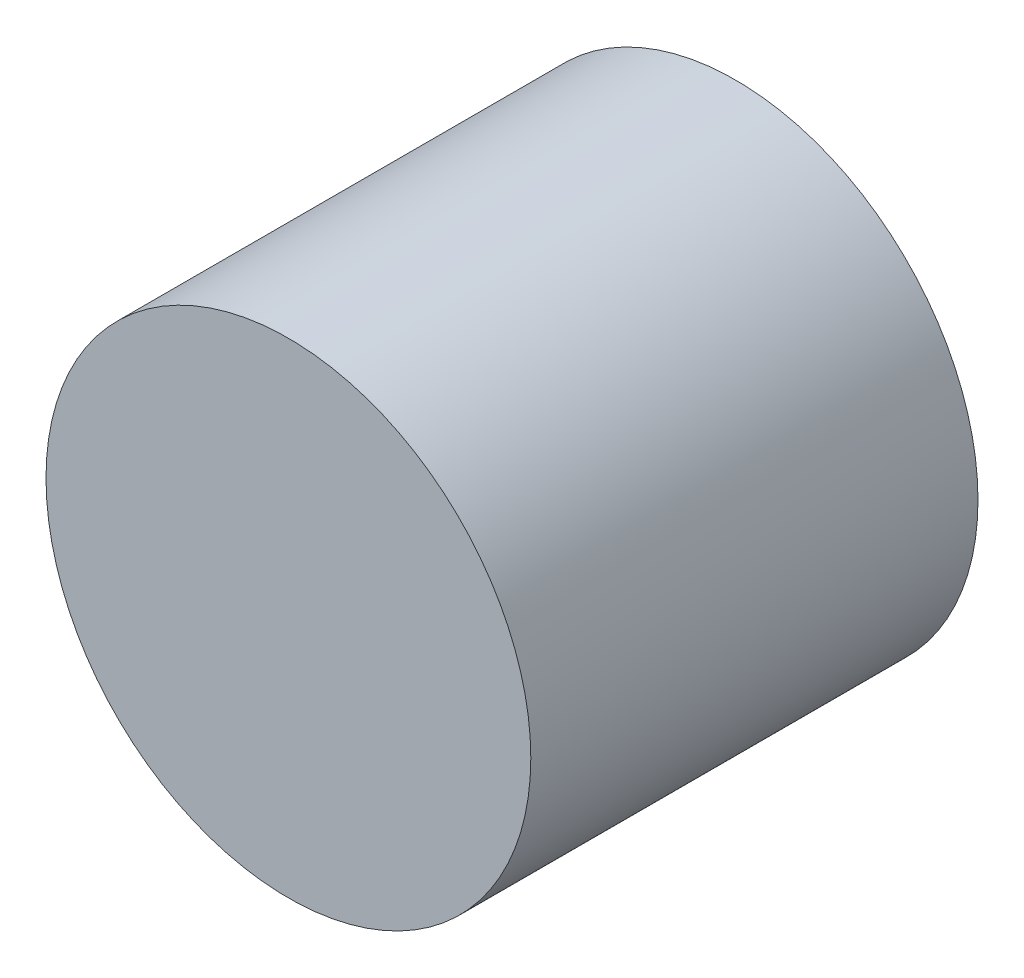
SolidWorks part; units mm, degrees
ref_plane "Plan de face" through (0, 0, 0) normal (0, 0, 1) x (1, 0, 0)
ref_plane "Plan de dessus" through (0, 0, 0) normal (0, 1, 0) x (1, 0, 0)
ref_plane "Plan de droite" through (0, 0, 0) normal (1, 0, 0) x (0, 0, -1)
sketch "Esquisse1" plane through (0, 0, 0) normal (0, 0, 1) x (1, 0, 0)
  circle A0 centre (0, 0) radius 31.9829
extrude "Boss.-Extru.1" add sketch "Esquisse1" along normal blind 59
sketch "Esquisse2" plane through (0, 0, 59) normal (0, 0, 1) x (1, 0, 0)
  circle A0 centre (-23.3448, -3.9163) radius 4.9632
